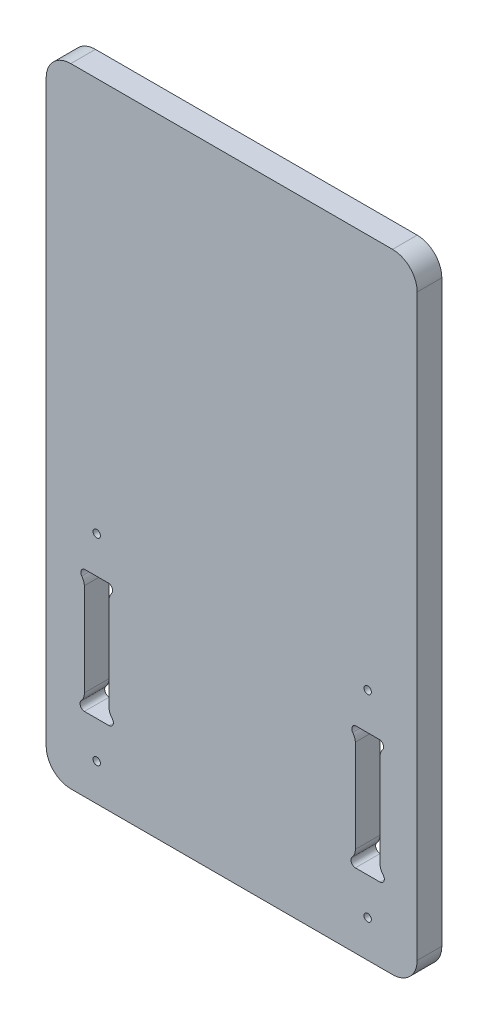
SolidWorks part; units mm, degrees
ref_plane "Plan de face" through (0, 0, 0) normal (0, 0, 1) x (1, 0, 0)
ref_plane "Plan de dessus" through (0, 0, 0) normal (0, 1, 0) x (1, 0, 0)
ref_plane "Plan de droite" through (0, 0, 0) normal (1, 0, 0) x (0, 0, -1)
sketch "Esquisse1" plane through (0, 0, 0) normal (0, 0, 1) x (1, 0, 0)
  line L4 (-65.5101, -55) -> (65.1021, -55)
  line L5 (75.1021, -45) -> (75.1021, 190)
  line L7 (-75.5101, 190) -> (-75.5101, -45)
  line L8 (-50, -25) -> (-60, -25)
  line L9 (-60, -18.4906) -> (-60, 19.1989)
  line L10 (-60, 25) -> (-50, 25)
  line L12 (-55, -104.8826) -> (-55, 70.6245) construction
  line L13 (-50, -18.4906) -> (-50, 19.1989)
  line L14 (-65.5101, 200) -> (65.1021, 200)
  line L15 (55, 0) -> (-55, 0) construction
  line L16 (0, -55) -> (0, 55) construction
  line L17 (55, -104.8826) -> (55, 70.6245) construction
  line L18 (50, -18.4906) -> (50, 19.1989)
  line L19 (60, 25) -> (50, 25)
  line L20 (60, -18.4906) -> (60, 19.1989)
  line L21 (50, -25) -> (60, -25)
  arc A8 (-75.5101, -45) -> (-65.5101, -55) centre (-65.5101, -45) ccw
  arc A9 (65.1021, -55) -> (75.1021, -45) centre (65.1021, -45) ccw
  arc A14 (-61.3779, -21.9779) -> (-60, -25) centre (-59.8722, -23.1166) ccw
  arc A15 (-61.3779, -21.9779) -> (-60, -18.4906) centre (-65.102, -18.4906) ccw
  arc A16 (-60, 19.1989) -> (-61.0488, 22.0156) centre (-65.0936, 18.9059) ccw
  arc A17 (-60, 25) -> (-61.0488, 22.0156) centre (-59.5522, 23.1661) ccw
  circle A22 centre (-55, -40) radius 1.5
  arc A24 (-48.6221, -21.9779) -> (-50, -18.4906) centre (-44.898, -18.4906) cw
  arc A25 (-48.6221, -21.9779) -> (-50, -25) centre (-50.1278, -23.1166) cw
  arc A26 (-50, 19.1989) -> (-48.9512, 22.0156) centre (-44.9064, 18.9059) cw
  arc A27 (-50, 25) -> (-48.9512, 22.0156) centre (-50.4478, 23.1661) cw
  arc A28 (-75.5101, 190) -> (-65.5101, 200) centre (-65.5101, 190) cw
  arc A29 (75.1021, 190) -> (65.1021, 200) centre (65.1021, 190) ccw
  circle A30 centre (-55, 40) radius 1.5
  arc A31 (48.6221, -21.9779) -> (50, -25) centre (50.1278, -23.1166) ccw
  arc A32 (48.6221, -21.9779) -> (50, -18.4906) centre (44.898, -18.4906) ccw
  arc A33 (50, 19.1989) -> (48.9512, 22.0156) centre (44.9064, 18.9059) ccw
  arc A34 (50, 25) -> (48.9512, 22.0156) centre (50.4478, 23.1661) ccw
  arc A35 (60, 25) -> (61.0488, 22.0156) centre (59.5522, 23.1661) cw
  arc A36 (60, 19.1989) -> (61.0488, 22.0156) centre (65.0936, 18.9059) cw
  arc A37 (61.3779, -21.9779) -> (60, -18.4906) centre (65.102, -18.4906) cw
  arc A38 (61.3779, -21.9779) -> (60, -25) centre (59.8722, -23.1166) cw
  circle A39 centre (55, -40) radius 1.5
  circle A40 centre (55, 40) radius 1.5
  dimension "D7" = 10
  dimension "D8" = 10
  dimension "D9" = 10
  dimension "D10" = 10
  dimension "D11" = 3
  dimension "D1" = 50
  dimension "D2" = 50
  dimension "D3" = 25
  dimension "D4" = 5
  dimension "D5" = 55
  dimension "D6" = 200
  dimension "D12" = 40
extrude "Boss.-Extru.1" add sketch "Esquisse1" along normal blind 10
chamfer "Chanfrein1" distance 2.2 angle 45 4 edges at (-53.5, -40, 0) (53.5, -40, 0) (-56.5, 40, 0) (56.5, 40, 0)
